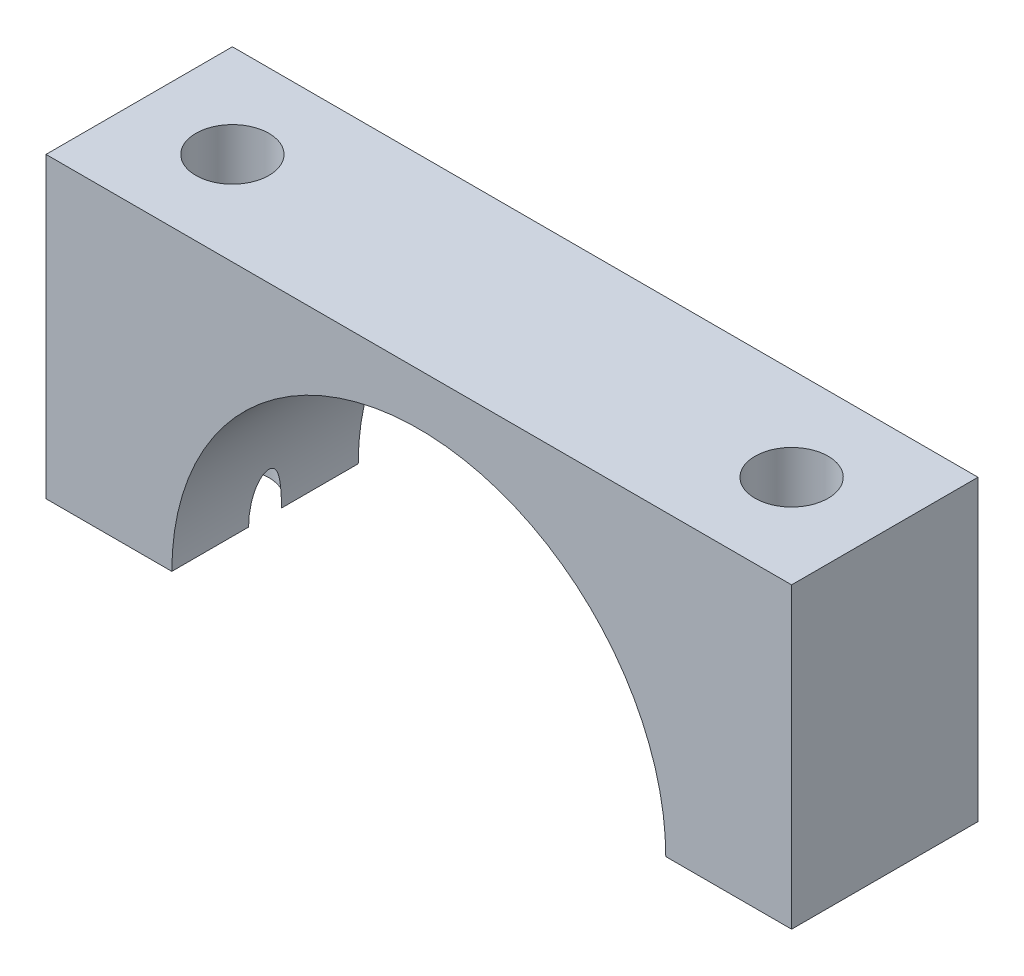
SolidWorks part; units mm, degrees
ref_plane "Front" through (0, 0, 0) normal (0, 0, 1) x (1, 0, 0)
ref_plane "Top" through (0, 0, 0) normal (0, 1, 0) x (1, 0, 0)
ref_plane "Right" through (0, 0, 0) normal (1, 0, 0) x (0, 0, -1)
sketch "Sketch1" plane through (0, 0, 0) normal (0, 0, 1) x (1, 0, 0)
  line L1 (0, 0) -> (50.8, 0) construction
  line L2 (0, 0) -> (0, 20.32)
  line L3 (0, 20.32) -> (50.8, 20.32)
  line L4 (50.8, 0) -> (50.8, 20.32)
  line L6 (25.4, 20.32) -> (25.4, 0) construction
  line L7 (0, 0) -> (8.5725, 0)
  line L8 (42.2275, 0) -> (50.8, 0)
  arc A0 (8.5725, 0) -> (42.2275, 0) centre (25.4, 0) cw
  dimension "D1" = 16.8275
  dimension "D2" = 20.32
  dimension "D3" = 50.8
extrude "Boss-Extrude1" add sketch "Sketch1" along normal blind 12.7
sketch "Sketch2" plane through (0, 20.32, 0) normal (0, 1, 0) x (1, 0, 0)
  line L0 (0, -6.35) -> (50.8, -6.35) construction
  line L1 (0, -12.7) -> (0, 0) construction
  line L2 (50.8, -12.7) -> (50.8, 0) construction
  circle A0 centre (6.35, -6.35) radius 2.4892
  circle A1 centre (44.45, -6.35) radius 2.4892
  circle A2 centre (0, -6.35) radius 6.35 construction
  circle A3 centre (50.8, -6.35) radius 6.35 construction
  point P6 (6.35, -6.35)
  point P7 (44.45, -6.35)
  point P12 (8.8392, -6.35)
  point P13 (41.9608, -6.35)
  dimension "D2" = 4.9784
  dimension "D1" = 38.1
extrude "Cut-Extrude2" cut sketch "Sketch2" against normal through all
